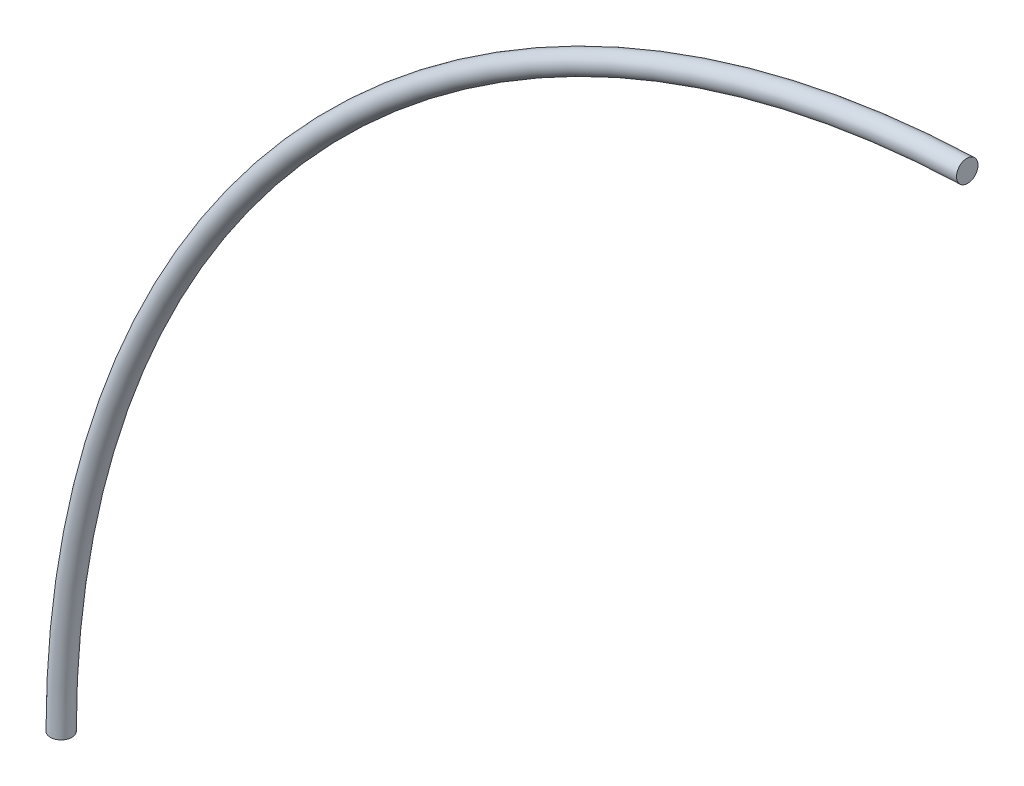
SolidWorks part; units mm, degrees
ref_plane "Front Plane" through (0, 0, 0) normal (0, 0, 1) x (1, 0, 0)
ref_plane "Top Plane" through (0, 0, 0) normal (0, 1, 0) x (1, 0, 0)
ref_plane "Right Plane" through (0, 0, 0) normal (1, 0, 0) x (0, 0, -1)
sketch "Sketch1" plane through (0, 0, 0) normal (0, 0, 1) x (1, 0, 0)
  line L0 (55, 0) -> (-55, 0) construction
  arc A0 (-347.3735, 0) -> (-12.1396, 347.1613) centre (0, 0) cw
  point P4 (0, 0)
  dimension "D1" = 482.6
sketch "Sketch2" plane through (0, 0, 0) normal (0, 1, 0) x (1, 0, 0)
  circle A0 centre (-347.3735, 0) radius 3.9688
  dimension "D1" = 7.9375
sweep "Sweep1" add profiles "Sketch2" path "Sketch1"
